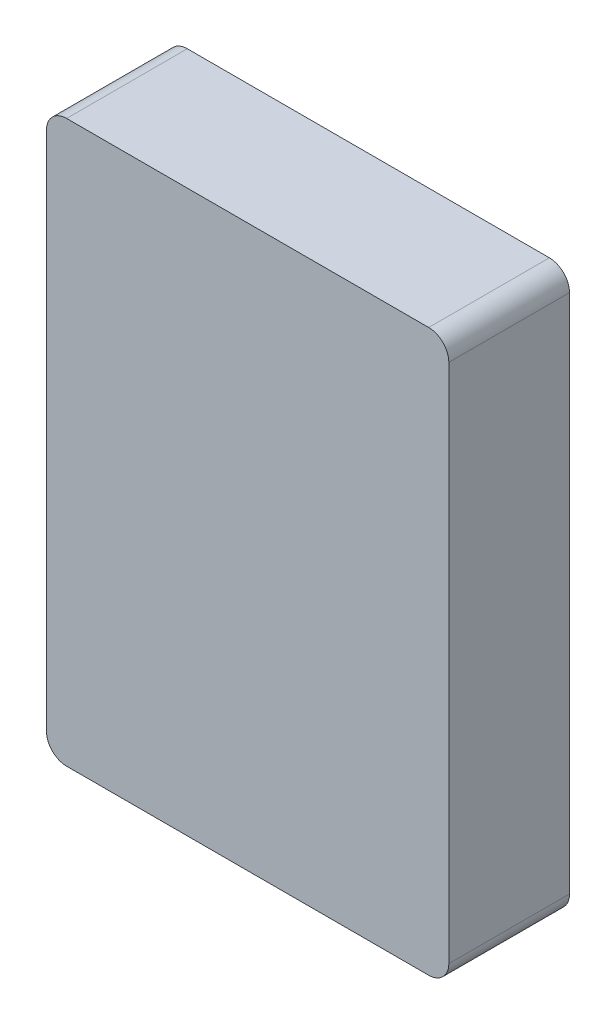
SolidWorks part; units mm, degrees
ref_plane "Front Plane" through (0, 0, 0) normal (0, 0, 1) x (1, 0, 0)
ref_plane "Top Plane" through (0, 0, 0) normal (0, 1, 0) x (1, 0, 0)
ref_plane "Right Plane" through (0, 0, 0) normal (1, 0, 0) x (0, 0, -1)
sketch "Sketch1" plane through (0, 0, 0) normal (0, 0, 1) x (1, 0, 0)
  line L1 (0, 0) -> (200, 0)
  line L2 (0, 0) -> (0, -278.88)
  line L3 (0, -278.88) -> (200, -278.88)
  line L4 (200, 0) -> (200, -278.88)
  dimension "D1" = 200
  dimension "D2" = 278.88
extrude "Boss-Extrude1" add sketch "Sketch1" along normal blind 60
fillet "Fillet1" radius 10 4 edges at (0, -278.88, 30) (200, -278.88, 30) (0, 0, 30) (200, 0, 30)
